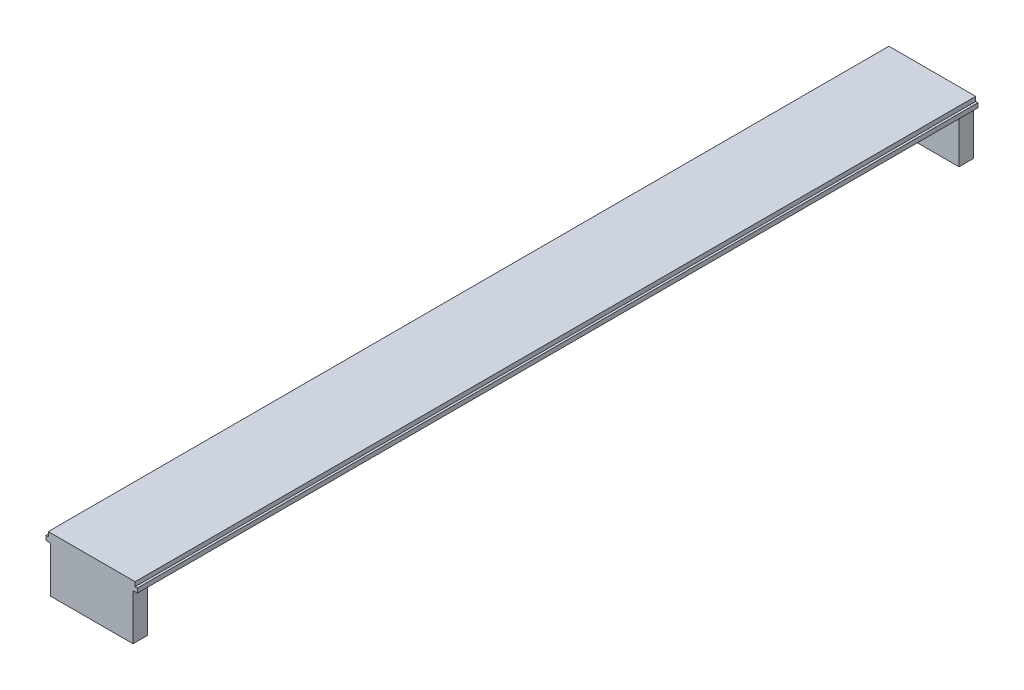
SolidWorks part; units mm, degrees
ref_plane "Front Plane" through (0, 0, 0) normal (0, 0, 1) x (1, 0, 0)
ref_plane "Top Plane" through (0, 0, 0) normal (0, 1, 0) x (1, 0, 0)
ref_plane "Right Plane" through (0, 0, 0) normal (1, 0, 0) x (0, 0, -1)
sketch "Sketch1" plane through (0, 0, 0) normal (0, 0, 1) x (1, 0, 0)
  line L0 (7.9375, 0) -> (7.9375, 1.524) construction
  line L1 (0, 0) -> (15.875, 0)
  line L2 (0, 0) -> (0, 0.762)
  line L3 (0.3937, 1.524) -> (15.4813, 1.524)
  line L4 (15.875, 0) -> (15.875, 0.762)
  line L7 (15.875, 0.762) -> (15.4813, 0.762)
  line L8 (15.4813, 1.524) -> (15.4813, 0.762)
  line L9 (0.3937, 1.524) -> (0.3937, 0.762)
  line L10 (0, 0.762) -> (0.3937, 0.762)
  dimension "D1" = 15.875
  dimension "D2" = 0.762
  dimension "D3" = 0.762
  dimension "D4" = 0.3937
extrude "Boss-Extrude1" add sketch "Sketch1" along normal blind 146.05
sketch "Sketch2" plane through (0, 0, 0) normal (0, -1, 0) x (1, 0, 0)
  line L0 (0, 73.025) -> (15.875, 73.025) construction
  line L1 (0, 146.05) -> (0, 0) construction
  line L2 (15.875, 146.05) -> (15.875, 0) construction
  line L3 (0, 146.05) -> (15.875, 146.05) construction
  line L4 (0.762, 146.05) -> (15.113, 146.05)
  line L5 (0.762, 146.05) -> (0.762, 143.51)
  line L6 (0.762, 143.51) -> (15.113, 143.51)
  line L7 (15.113, 146.05) -> (15.113, 143.51)
  line L8 (15.113, 0) -> (15.113, 2.54)
  line L9 (0.762, 2.54) -> (15.113, 2.54)
  line L10 (0.762, 0) -> (0.762, 2.54)
  line L11 (0.762, 0) -> (15.113, 0)
  point P12 (7.9375, 146.05)
  dimension "D1" = 14.351
  dimension "D2" = 2.54
extrude "Boss-Extrude2" add sketch "Sketch2" along normal blind 8.001
sketch "Sketch3" plane through (0, 0, 2.54) normal (0, 0, 1) x (1, 0, 0)
  line L0 (15.113, -8.001) -> (0.762, -8.001) construction
  line L1 (7.9375, -8.001) -> (7.9375, 0) construction
  line L2 (15.113, 0) -> (0.762, 0) construction
  circle A0 centre (7.9375, -3.2385) radius 2.3813
  dimension "D2" = 4.7625
  dimension "D1" = 4.7625
extrude "Cut-Extrude1" cut sketch "Sketch3" against normal through all
